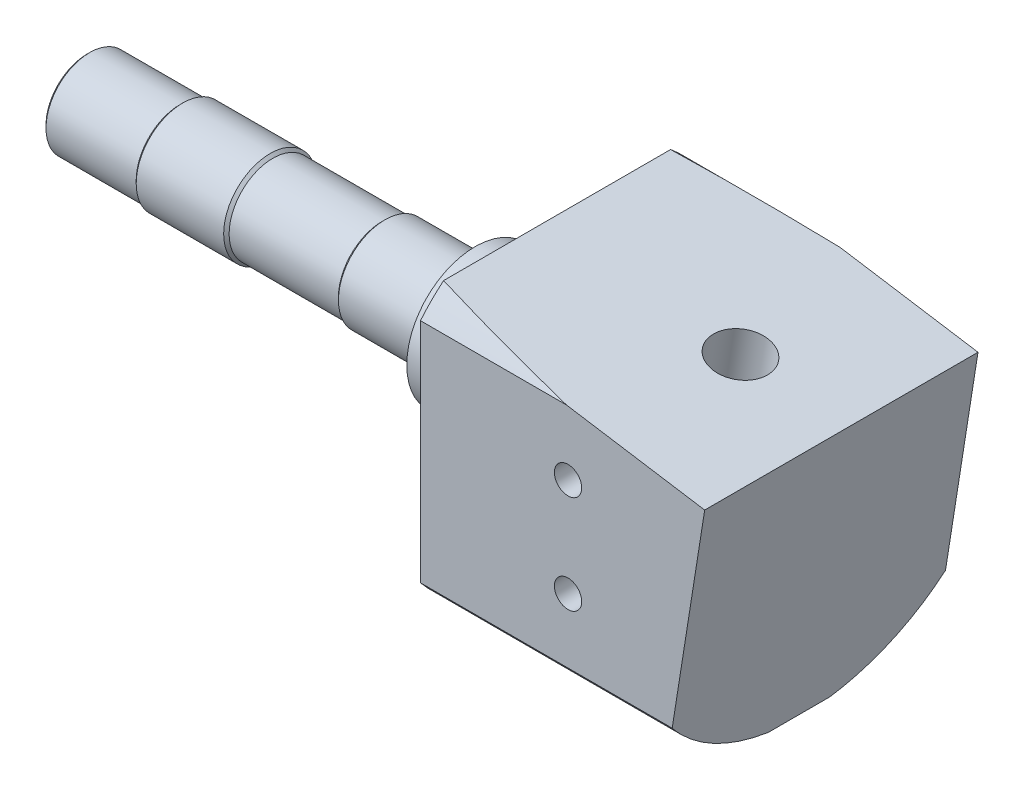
SolidWorks part; units mm, degrees
ref_plane "Face" through (0, 0, 0) normal (0, 0, 1) x (1, 0, 0)
ref_plane "Dessus" through (0, 0, 0) normal (0, 1, 0) x (1, 0, 0)
ref_plane "Droite" through (0, 0, 0) normal (1, 0, 0) x (0, 0, -1)
sketch "Esquisse1" plane through (0, 0, 0) normal (0, 0, 1) x (1, 0, 0)
  line L0 (0, 0) -> (0, 8)
  line L1 (0, 8) -> (17, 8)
  line L2 (17, 8) -> (17, 8.5)
  line L3 (17, 8.5) -> (34, 8.5)
  line L4 (34, 8.5) -> (34, 8)
  line L5 (34, 8) -> (54, 8)
  line L6 (54, 8) -> (54, 8.5)
  line L7 (54, 8.5) -> (71, 8.5)
  line L8 (71, 8.5) -> (71, 12.5)
  line L9 (71, 12.5) -> (86, 12.5)
  line L10 (86, 0) -> (86, 12.5)
  line L13 (86, 0) -> (0, 0)
  line L14 (-24.7781, 0) -> (239.1165, 0) construction
  dimension "D1" = 16
  dimension "D2" = 17
  dimension "D3" = 17
  dimension "D4" = 20
  dimension "D5" = 17
  dimension "D6" = 17
  dimension "D7" = 25
  dimension "D8" = 15
revolve "Base-Révolution" add sketch "Esquisse1" angle 360 about L14
chamfer "Chanfrein1" distance 0.5 angle 45
sketch "Esquisse7" plane through (0, 0, 0) normal (0, 0, 1) x (1, 0, 0)
  line L0 (86, 25) -> (86, -25)
  line L1 (86, -12.5) -> (86, 12.5) construction
  line L2 (71, -12.5) -> (86, -12.5) construction
  line L4 (86, 25) -> (138, 16.764)
  line L5 (86, -25) -> (130.2746, -32.0124)
  line L6 (138, 16.764) -> (130.2746, -32.0124)
  dimension "D1" = 52
  dimension "D2" = 37.5
  dimension "D3" = 50
  dimension "D4" = 81
extrude "Boss.-Extru.1" add sketch "Esquisse7" along normal mid plane 50
sketch "Esquisse8" plane through (86, 0, 0) normal (-1, 0, 0) x (0, 0, 1)
  circle A0 centre (0, 0) radius 32.5
  circle A1 centre (0, 0) radius 12.5 construction
  circle A2 centre (0, 0) radius 45
  dimension "D1" = 65
  dimension "D2" = 90
extrude "Enlèv. mat.-Extru.7" cut sketch "Esquisse8" against normal through all
sketch "Esquisse11" plane through (5.9673, 37.6759, 0) normal (0.1564, 0.9877, 0) x (-0.9877, 0.1564, 0)
  circle A0 centre (-115, 0) radius 5
  dimension "D1" = 10
  dimension "D2" = 115
extrude "Enlèv. mat.-Extru.10" cut sketch "Esquisse11" against normal through all
sketch "Esquisse12" plane through (0, 0, 25) normal (0, 0, 1) x (1, 0, 0)
  line L1 (86, 20.7666) -> (86, -20.7666) construction
  circle A0 centre (113, 9) radius 2.5
  circle A1 centre (113, -9) radius 2.5
  dimension "D1" = 5
  dimension "D2" = 27
  dimension "D3" = 18
  dimension "D4" = 9
extrude "Enlèv. mat.-Extru.11" cut sketch "Esquisse12" against normal blind 18
